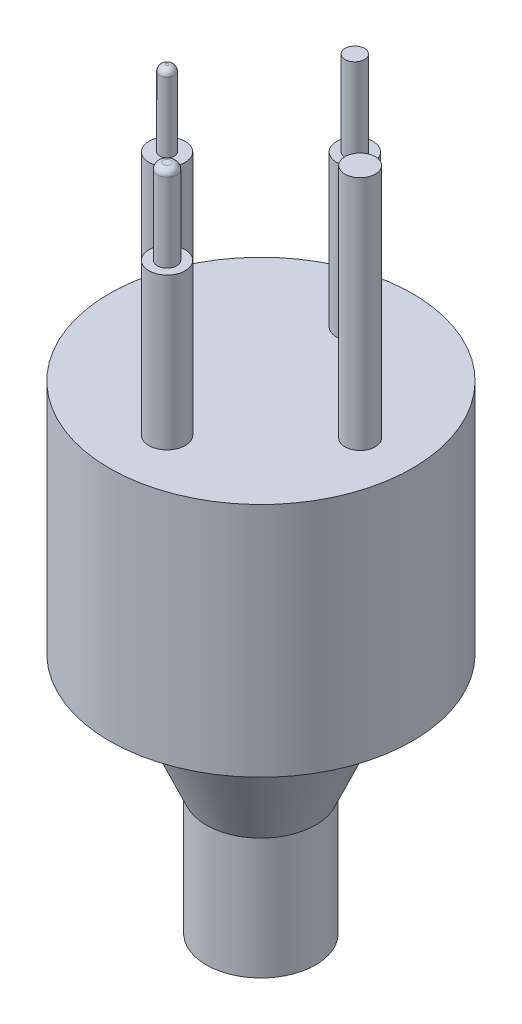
SolidWorks part; units mm, degrees
ref_plane "Front" through (0, 0, 0) normal (0, 0, 1) x (1, 0, 0)
ref_plane "Top" through (0, 0, 0) normal (0, 1, 0) x (1, 0, 0)
ref_plane "Right" through (0, 0, 0) normal (1, 0, 0) x (0, 0, -1)
sketch "Sketch1" plane through (0, 0, 0) normal (0, 0, 1) x (1, 0, 0)
  line L0 (0, 55.7282) -> (0, -38.7212) construction
  line L1 (0, 0) -> (-4.583, 0)
  line L2 (-9.015, 20.32) -> (-4.583, 10.16)
  line L3 (-9.015, 20.32) -> (-12.7, 20.32)
  line L4 (-12.7, 20.32) -> (-12.7, 40.132)
  line L5 (-12.7, 40.132) -> (0, 40.132)
  line L6 (0, 40.132) -> (0, 0)
  line L7 (-4.583, 10.16) -> (-4.583, 0)
  dimension "D1" = 25.4
  dimension "D2" = 10.16
  dimension "D3" = 10.16
  dimension "D4" = 19.812
  dimension "D5" = 18.03
  dimension "D6" = 9.166
revolve "Revolve1" add sketch "Sketch1" angle 360 about L0
sketch "Sketch2" plane through (0, 40.132, 0) normal (0, 1, 0) x (-1, 0, 0)
  line L1 (0, 0) -> (0, 7.874) construction
  circle A0 centre (0, 7.874) radius 1.524
  dimension "D2" = 3.048
  dimension "D1" = 7.874
extrude "Extrude1" add sketch "Sketch2" along normal blind 12.7
sketch "Sketch3" plane through (0, 52.832, 0) normal (0, 1, 0) x (-1, 0, 0)
  circle A0 centre (0, 7.874) radius 0.8138
  circle A1 centre (0, 7.874) radius 1.524 construction
  dimension "D1" = 1.6276
extrude "Extrude2" add sketch "Sketch3" along normal blind 7.112
fillet "Fillet1" radius 0.508 1 edges at (0, 59.944, 8.6878)
mirror "Mirror1" about plane through (0, 0, 0) normal (0, 0, 1) of "Extrude2", "Extrude1"
sketch "Sketch4" plane through (0, 40.132, 0) normal (0, 1, 0) x (-1, 0, 0)
  line L0 (-16.6338, 0) -> (0, 0) construction
  circle A0 centre (-8.3169, 0) radius 1.27
  dimension "D1" = 2.54
  dimension "D2" = 8.3169
extrude "Extrude3" add sketch "Sketch4" along normal blind 19.812
pattern_circular "CirPattern4" count 2 over 90 about axis through (0, 55.7282, 0) along (0, -1, 0) of "Extrude1"
sketch "Sketch5" plane through (0, 52.832, 0) normal (0, 1, 0) x (-1, 0, 0)
  circle A0 centre (7.874, 0) radius 0.6165
  circle A1 centre (7.874, 0) radius 1.524 construction
extrude "Extrude4" add sketch "Sketch5" along normal blind 6.35
fillet "Fillet2" radius 0.508 1 edges at (-7.874, 59.182, 0.6165)
